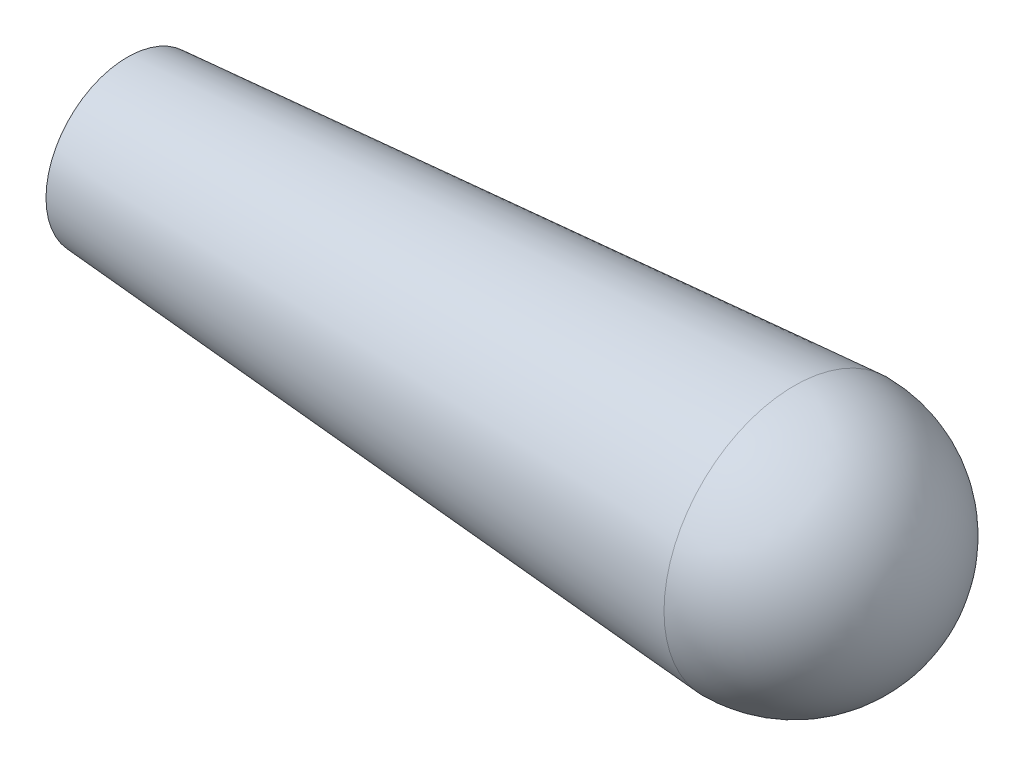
SolidWorks part; units mm, degrees
ref_plane "Front Plane" through (0, 0, 0) normal (0, 0, 1) x (1, 0, 0)
ref_plane "Top Plane" through (0, 0, 0) normal (0, 1, 0) x (1, 0, 0)
ref_plane "Right Plane" through (0, 0, 0) normal (1, 0, 0) x (0, 0, -1)
sketch "Sketch1" plane through (0, 0, 0) normal (0, 0, 1) x (1, 0, 0)
  line L0 (-26.126, 0) -> (55.874, 0)
  line L1 (55.874, 0) -> (55.874, -16)
  line L2 (55.874, -16) -> (-26.126, -10)
  line L3 (-26.126, -10) -> (-26.126, 0)
  line L4 (71.874, 0) -> (55.874, 0)
  arc A0 (55.874, -16) -> (71.874, 0) centre (55.874, 0) ccw
  dimension "D1" = 16
  dimension "D2" = 10
  dimension "D3" = 82
revolve "Revolve2" add sketch "Sketch1" angle 360 about L0
sketch "Sketch2" plane through (-26.126, 0, 0) normal (-1, 0, 0) x (0, 0, 1)
  line L1 (-8, -3) -> (8, -3)
  line L2 (-8, -3) -> (-8, 3)
  line L3 (-8, 3) -> (8, 3)
  line L4 (8, -3) -> (8, 3)
  line L5 (-8, -3) -> (8, 3) construction
  line L6 (-8, 3) -> (8, -3) construction
  point P0 (0, 0)
  dimension "D1" = 6
  dimension "D2" = 16
extrude "Cut-Extrude1" cut sketch "Sketch2" against normal blind 78
